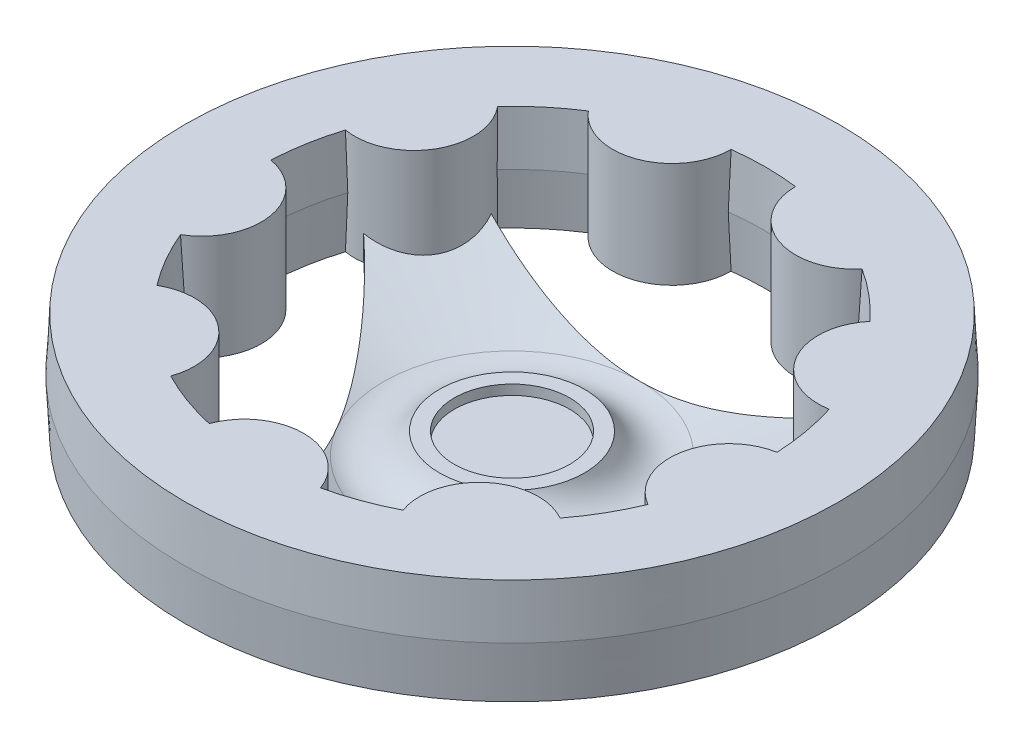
SolidWorks part; units mm, degrees
ref_plane "Front Plane" through (0, 0, 0) normal (0, 0, 1) x (1, 0, 0)
ref_plane "Top Plane" through (0, 0, 0) normal (0, 1, 0) x (1, 0, 0)
ref_plane "Right Plane" through (0, 0, 0) normal (1, 0, 0) x (0, 0, -1)
sketch "Sketch1" plane through (0, 0, 0) normal (0, 0, 1) x (1, 0, 0)
  line L0 (0, 0) -> (0, 45.9521) construction
  line L1 (0, 0) -> (20, 0)
  line L2 (20, 0) -> (20, -21)
  line L3 (20, -21) -> (22, -23)
  line L4 (22, -23) -> (22, -25)
  line L5 (22, -25) -> (20, -25)
  line L6 (20, -25) -> (20, -39.4)
  line L7 (19.4, -40) -> (3.6, -40)
  line L8 (0, -10) -> (0, 0)
  line L9 (0, -10) -> (3, -11.7321)
  line L10 (3, -11.7321) -> (3, -39.4)
  line L11 (3, -39.4) -> (3.6, -40)
  line L12 (20, -39.4) -> (19.4, -40)
  point P9 (20, -40)
  point P13 (3, -40)
revolve "Revolve1" add sketch "Sketch1" angle 360 about L0
sketch "Sketch2" plane through (0, 0, 0) normal (0, 0, 1) x (1, 0, 0)
  line L0 (20, 0) -> (-20, 0) construction
  line L1 (20, -21) -> (20, 0) construction
  line L2 (22, -23) -> (20, -21) construction
  line L3 (22, -25) -> (22, -23) construction
  line L4 (20, 0) -> (17.5, 0)
  line L5 (20, -21) -> (20, 0)
  line L6 (22, -23) -> (20, -21)
  line L7 (22, -25) -> (22, -23)
  line L8 (17.5, 0) -> (17.5, 3)
  line L9 (17.5, 3) -> (22, 3)
  line L10 (22, -25) -> (24, -25)
  line L11 (24, -25) -> (24, -20.4932)
  line L12 (28.1693, -14.312) -> (72.1675, 3.4644)
  line L13 (80.8, 2) -> (80.8, 29.2)
  line L14 (80.8, 29.2) -> (95.2, 29.2)
  line L15 (95.2, 29.2) -> (95.2, 2)
  line L16 (95.2, 2) -> (99.1615, 2)
  line L17 (100, 2) -> (100, 34) construction
  line L18 (99.1615, 34) -> (76.8385, 34)
  line L19 (76, 34) -> (76, 2) construction
  line L20 (76, 2) -> (80.8, 2)
  line L21 (0, 0) -> (0, -29.5318) construction
  line L22 (-19.4, -40) -> (19.4, -40) construction
  line L23 (38.9607, -3.4808) -> (76, 11.4841)
  line L24 (100, 18) -> (99.1615, 34)
  line L25 (100, 18) -> (99.1615, 2)
  line L26 (100, 18) -> (76, 18) construction
  line L27 (76, 18) -> (76.8385, 34)
  line L28 (76, 18) -> (76, 11.4841)
  line L29 (22, 3) -> (22, -10.3333) construction
  line L30 (22, -10.3333) -> (38.9607, -3.4808) construction
  line L31 (72.1675, 3.4644) -> (76, 5.0129) construction
  arc A0 (76, 2) -> (72.1675, 3.4644) centre (73.2961, 0.6709) ccw
  arc A1 (22, 3) -> (38.9607, -3.4808) centre (33.9659, 8.8817) ccw
  arc A2 (28.1693, -14.312) -> (24, -20.4932) centre (30.6667, -20.4932) ccw
  point P30 (24, -15.9965)
revolve "Revolve2" add sketch "Sketch2" angle 360 about L21
sketch "Sketch3" plane through (0, 34, 0) normal (0, 1, 0) x (1, 0, 0)
  line L0 (0, 0) -> (0, 72.8617) construction
  line L1 (0, 0) -> (68.2353, 39.3957) construction
  line L2 (0, 0) -> (-63.5801, 36.708) construction
  line L3 (0, 0) -> (58.2194, 48.8519) construction
  line L4 (0, 0) -> (-58.2194, 48.8519) construction
  arc A2 (58.2194, 48.8519) -> (-58.2194, 48.8519) centre (0, 0) ccw
  arc A3 (-58.2194, 48.8519) -> (58.2194, 48.8519) centre (0, 215.2458) ccw
  circle A4 centre (0, 0) radius 38.9607 construction
  circle A5 centre (0, 0) radius 76 construction
  dimension "D1" = 120
  dimension "D2" = 10
extrude "Extrude1" cut sketch "Sketch3" against normal through all
pattern_circular "CirPattern1" count 3 over 360 about axis through (0, 0, 0) along (0, 1, 0) of "Extrude1"
ref_plane "Plane2" through (0, 18, 0) normal (0, 1, 0) x (-1, 0, 0)
draft "Draft5" type of draft neutral plane draft angle 3 neutral plane "Plane2" faces to draft 1 parameters "D1"=3
sketch "Sketch5" plane through (0, 34, 0) normal (0, 1, 0) x (1, 0, 0)
  line L0 (0, -76.8385) -> (0, -99.1615) construction
  circle A0 centre (0, 0) radius 76.8385 construction
  circle A1 centre (0, 0) radius 99.1615 construction
  arc A2 (16.8971, -74.9576) -> (-16.8971, -74.9576) centre (0, -81.1615) ccw
  arc A3 (-16.8971, -74.9576) -> (16.8971, -74.9576) centre (0, 0) ccw
  arc A4 (-16.8971, -74.9576) -> (16.8971, -74.9576) centre (0, -81.1615) ccw construction
  dimension "D1" = 18
extrude "Extrude2" add sketch "Sketch5" against normal up to surface (32 mm away)
pattern_circular "CirPattern2" count 9 over 360 about axis through (0, 0, 0) along (0, 1, 0) of "Extrude2"
sketch "Sketch6" plane through (0, 29.2, 0) normal (0, -1, 0) x (1, 0, 0)
  circle A1 centre (0, 81.1615) radius 18
  arc A2 (-16.8971, 74.9576) -> (-11.7526, 67.5278) centre (0, 81.1615) ccw construction
extrude "Extrude3" add sketch "Sketch6" along normal up to surface (27.2 mm away)
sketch "Sketch9" plane through (0, 0, 0) normal (1, 0, 0) x (0, 0, -1)
  line L0 (-81.1615, 5.64) -> (-81.1615, -17.9981) construction
  line L1 (-81.1615, 2) -> (-81.1615, 34) construction
  line L2 (-75.1615, 2) -> (-75.1615, 5)
  line L3 (-74.9576, 2) -> (-67.5278, 2) construction
  line L4 (-75.1615, 5) -> (-78.1615, 8)
  line L5 (-78.1615, 8) -> (-78.1615, 12)
  line L6 (-78.1615, 12) -> (-81.1615, 12)
  line L7 (-81.1615, 12) -> (-81.1615, 2)
  line L8 (-94.4181, 2) -> (-78.8048, 2) construction
  line L9 (-81.1615, 2) -> (-75.1615, 2)
  dimension "D1" = 45
  dimension "D2" = 12
  dimension "D3" = 3
  dimension "D4" = 3
  dimension "D5" = 4
revolve "Cut-Revolve1" cut sketch "Sketch9" angle 360 about L0
equation "\"D3@Sketch1\" = \"D2@Sketch1\"*.05"
equation "\"D8@Sketch1\" = \"D5@Sketch1\"*0.75"
equation "\"D9@Sketch1\" = \"D6@Sketch1\"*0.1"
equation "\"D12@Sketch1\" = \"D9@Sketch1\""
equation "\"D10@Sketch1\" = \"D9@Sketch1\""
equation "\"D11@Sketch1\" = \"D9@Sketch1\""
equation "\"D4@Sketch2\" = \"D3@Sketch2\"*0.15"
equation "\"D5@Sketch2\" = \"D4@Sketch2\""
equation "\"D8@Sketch2\" = \"D5@Sketch2\""
equation "\"D12@Sketch2\" = \"D6@Sketch2\"*0.06"
equation "\"D1@Sketch2\" = \"D3@Sketch1\""
equation "\"D15@Sketch2\" = \"D9@Sketch2\""
equation "\"D17@Sketch2\" = \"D9@Sketch2\"*0.5"
equation "\"D11@Sketch2\" = \"D22@Sketch2\""
